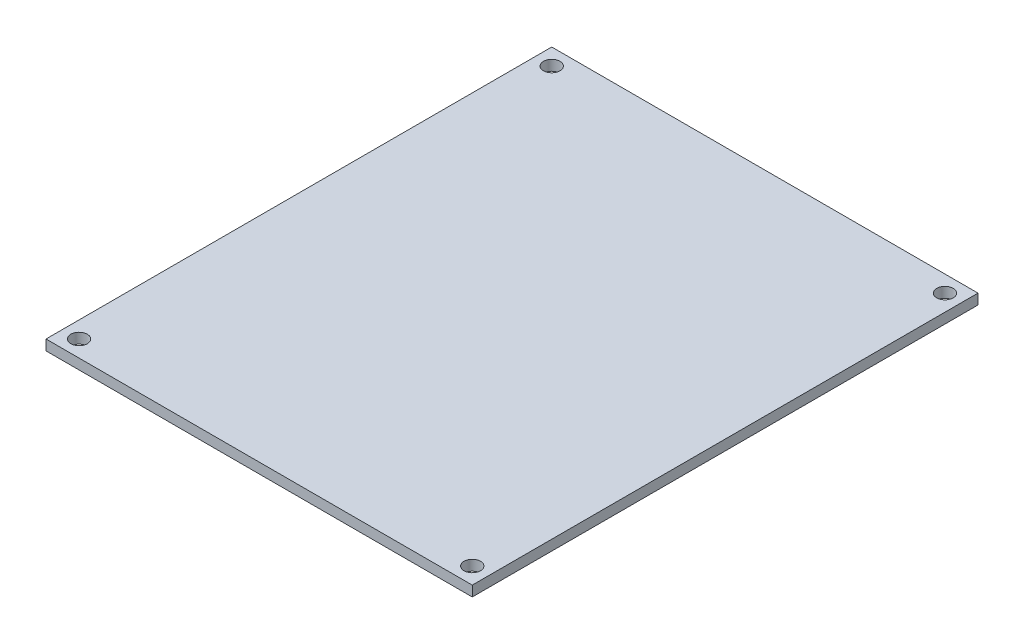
SolidWorks part; units mm, degrees
ref_plane "Front Plane" through (0, 0, 0) normal (0, 0, 1) x (1, 0, 0)
ref_plane "Top Plane" through (0, 0, 0) normal (0, 1, 0) x (1, 0, 0)
ref_plane "Right Plane" through (0, 0, 0) normal (1, 0, 0) x (0, 0, -1)
sketch "Sketch1" plane through (0, 0, 0) normal (0, 1, 0) x (1, 0, 0)
  line L1 (41.3, 49) -> (-41.3, 49)
  line L2 (41.3, 49) -> (41.3, -49)
  line L3 (41.3, -49) -> (-41.3, -49)
  line L4 (-41.3, 49) -> (-41.3, -49)
  line L5 (41.3, 49) -> (-41.3, -49) construction
  line L6 (41.3, -49) -> (-41.3, 49) construction
  point P0 (0, 0)
  dimension "D1" = 82.6
  dimension "D2" = 98
extrude "Boss-Extrude1" add sketch "Sketch1" along normal blind 2
hole_wizard "Ø3.2 (3.2) Diameter Hole1" positions "Sketch3" profile "Sketch2" hole size "Ø3.2" standard "ISO"
sketch "Sketch3" plane through (0, 2, 0) normal (0, 1, 0) x (1, 0, 0)
  line L0 (-41.3, 49) -> (-41.3, -49) construction
  line L1 (41.3, 49) -> (-41.3, 49) construction
  line L2 (41.3, -49) -> (41.3, 49) construction
  line L3 (-41.3, -49) -> (41.3, -49) construction
  point P0 (-38.1, 45.8)
  point P2 (38.1, 45.8)
  point P4 (38.1, -45.8)
  point P6 (-38.1, -45.8)
  dimension "D1" = 3.2
  dimension "D2" = 3.2
  dimension "D3" = 3.2
  dimension "D4" = 3.2
  dimension "D5" = 3.2
  dimension "D6" = 3.2
  dimension "D7" = 3.2
  dimension "D8" = 3.2
sketch "Sketch2" plane through (-38.1, 2, -45.8) normal (1, 0, 0) x (0, 0, 1)
  line L0 (0, 0) -> (0, 2)
  line L1 (0, 2) -> (1.6, 2)
  line L2 (1.6, 2) -> (1.6, 0)
  line L5 (1.6, 0) -> (0, 0)
  line L11 (0, -6.35) -> (0, 107.95) construction
  dimension "Thru Hole Dia." = 3.2
  dimension "Thru Hole Depth" = 2
